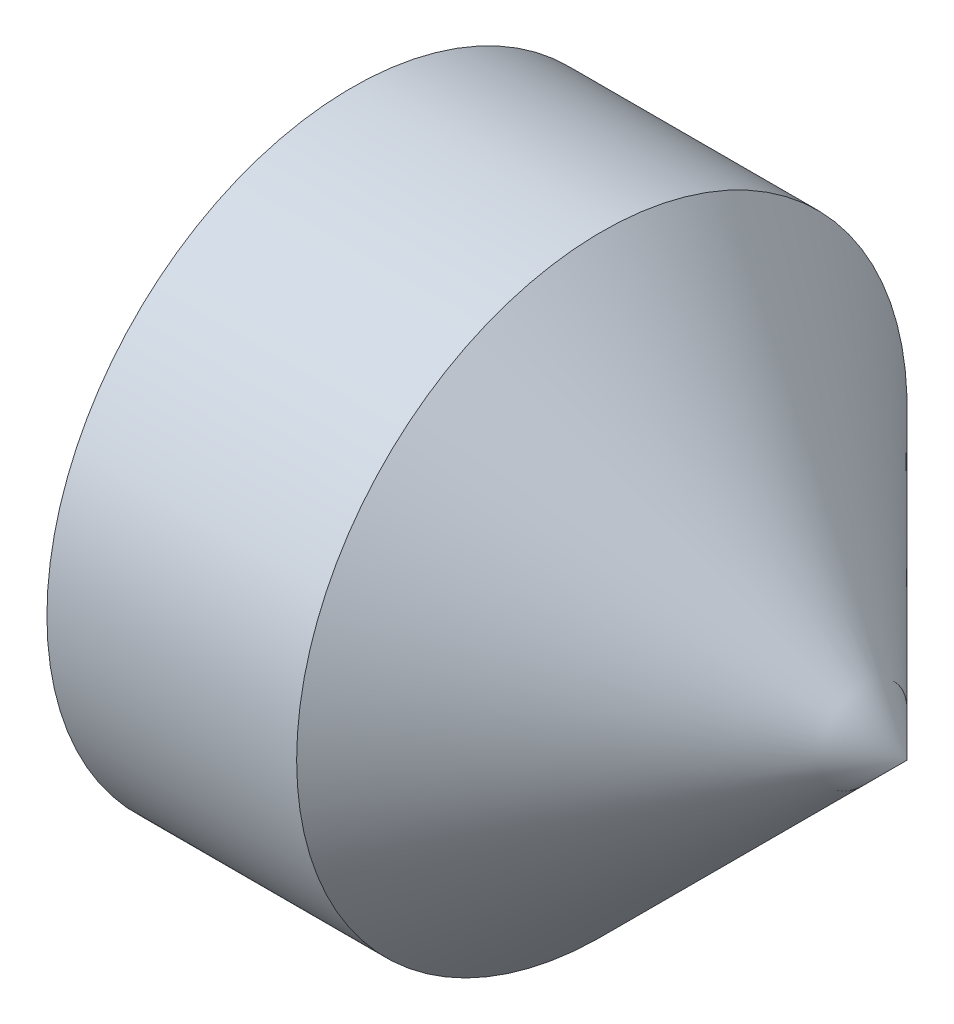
SolidWorks part; units mm, degrees
ref_plane "Plane1" through (0, 0, 0) normal (0, 0, 1) x (1, 0, 0)
ref_plane "Plane2" through (0, 0, 0) normal (0, 1, 0) x (1, 0, 0)
ref_plane "Plane3" through (0, 0, 0) normal (1, 0, 0) x (0, 0, -1)
sketch "BodySke" plane through (0, 0, 0) normal (0, 0, 1) x (1, 0, 0)
  line L0 (0, 0) -> (0, 2.055)
  line L1 (0, 2.055) -> (0.5456, 3)
  line L2 (0.5456, 3) -> (3, 3)
  line L3 (3, 3) -> (6, 0)
  line L4 (6, 0) -> (0, 0)
  line L5 (-12.7, 0) -> (88.9, 0) construction
  line L6 (3, -3) -> (6, 0) construction
  line L7 (0.4, 15.875) -> (0.4, -3.175) construction
  line L8 (0, -2.055) -> (0.5456, -3) construction
  dimension "Cone_ang" = 90
  dimension "Length" = 6
  dimension "Diameter" = 6
  dimension "Drive_ch_ang" = 60
  dimension "Minor_dia" = 4.11
  dimension "Advance" = 0.8
revolve "BaseBody" add sketch "BodySke" angle 360 about L5
sketch "Sketch2" plane through (0, 0, 0) normal (-1, 0, 0) x (0, 0, 1)
  line L0 (0.7217, 1.25) -> (-0.7217, 1.25)
  line L1 (-0.7217, 1.25) -> (-1.4434, 0)
  line L2 (0.7217, 1.25) -> (1.4434, 0)
  line L3 (0.7217, -1.25) -> (1.4434, 0)
  line L4 (0.7217, -1.25) -> (-0.7217, -1.25)
  line L5 (-0.7217, -1.25) -> (-1.4434, 0)
  dimension "Hex_size" = 2.5
  dimension "D2" = 1.25
  dimension "D3" = 1.25
extrude "Hex" cut sketch "Sketch2" against normal blind 3
sketch "ThdSchSke" plane through (0, 0, 0) normal (0, 0, 1) x (1, 0, 0)
  line L0 (0.5456, -2.055) -> (-0.1161, -3)
  line L1 (0.5456, -2.055) -> (1.2073, -3)
  line L2 (1.2073, -3) -> (1.2073, -3.75)
  line L3 (-3.175, 0) -> (5.1513, 0) construction
  line L4 (0.5456, -3) -> (0.5456, 3) construction
  line L5 (1.2073, -3.75) -> (-0.1161, -3.75)
  line L6 (-0.1161, -3.75) -> (-0.1161, -3)
  dimension "Thread_minor" = 4.11
  dimension "Diameter" = 6
  dimension "SideAngle" = 55
  dimension "VeeAngle" = 70
  dimension "Overcut" = 7.5
revolve "ThreadSchematic" [suppressed] cut sketch "ThdSchSke" angle 360 about L3
pattern_linear "ThdSchPat" [suppressed]
equation "\"D2@Sketch2\" = \"Hex_size@Sketch2\" / 2"
equation "\"D3@Sketch2\" = \"Hex_size@Sketch2\" / 2"
equation "\"Thread_minor@ThreadCosmetic\" = \"Minor_dia@BodySke\""
equation "\"Thread_minor@ThdSchSke\" = \"Thread_minor@ThreadCosmetic\""
equation "\"Diameter@ThdSchSke\" = \"Diameter@BodySke\""
equation "\"Overcut@ThdSchSke\" = \"Diameter@BodySke\" * 1.25"
equation "\"Num_threads@ThdSchPat\" = int( (\"Length@BodySke\" - ( ( ( \"Diameter@BodySke\" - \"Minor_dia@BodySke\" ) * 0.5 ) / tan( \"Drive_ch_ang@BodySke\" * 0.017453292 ) ) - ( ( \"Diameter@BodySke\" * 0.5 ) / tan( \"Con"
equation "\"Advance@ThdSchPat\" = (\"Length@BodySke\" - ( ( ( \"Diameter@BodySke\" - \"Minor_dia@BodySke\" ) * 0.5 ) / tan( \"Drive_ch_ang@BodySke\" * 0.017453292 ) ) - ( ( \"Diameter@BodySke\" * 0.5 ) / tan( \"Cone_ang@Bod"
equation "' \"Num_threads@ThdSchPat\" = \"Num_threads@ThdSchPat\" - sgn( \"Num_threads@ThdSchPat\" - 1) '---chamfered tips only---"
